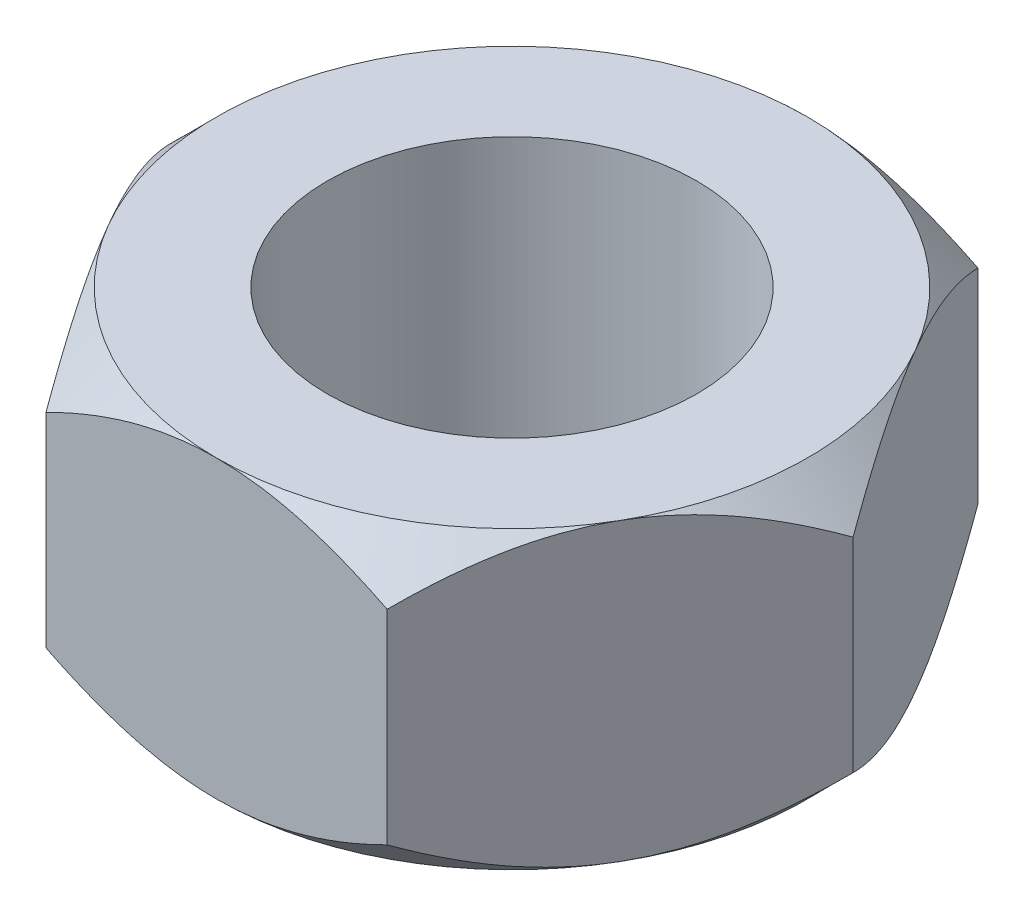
SolidWorks part; units mm, degrees
ref_plane "Face" through (0, 0, 0) normal (0, 0, 1) x (1, 0, 0)
ref_plane "Dessus" through (0, 0, 0) normal (0, 1, 0) x (1, 0, 0)
ref_plane "Coté" through (0, 0, 0) normal (1, 0, 0) x (0, 0, -1)
sketch "Esquisse1" plane through (0, 0, 0) normal (0, 1, 0) x (1, 0, 0)
  line L0 (-77.0213, 0) -> (92.0353, 0) construction
  line L1 (4.6188, 0) -> (2.3094, 4)
  line L2 (4.6188, 0) -> (2.3094, -4)
  line L3 (0, 76.4208) -> (0, -85.7294) construction
  line L4 (-4.6188, 0) -> (-2.3094, -4)
  line L5 (-4.6188, 0) -> (-2.3094, 4)
  line L6 (-2.3094, 4) -> (2.3094, 4)
  line L7 (-2.3094, -4) -> (2.3094, -4)
  circle A0 centre (0, 0) radius 2.5
  dimension "Diamètre" = 5
  dimension "D1" = 120
  dimension "Cote sur plat" = 8
extrude "Base-Extrusion" add sketch "Esquisse1" along normal blind 4
sketch "Esquisse2" plane through (0, 4, 0) normal (0, 1, 0) x (-1, 0, 0)
  line L0 (-4.6188, 0) -> (-2.3094, 4) construction
  circle A0 centre (0, 0) radius 4
extrude "Enlèv. mat.-Extru.2" cut sketch "Esquisse2" against normal through all draft 45 flip side to cut
sketch "Esquisse3" plane through (0, 0, 0) normal (0, -1, 0) x (1, 0, 0)
  line L0 (4.6188, 0) -> (2.3094, -4) construction
  circle A0 centre (0, 0) radius 4
extrude "Enlèv. mat.-Extru.3" cut sketch "Esquisse3" against normal through all draft 45 flip side to cut
